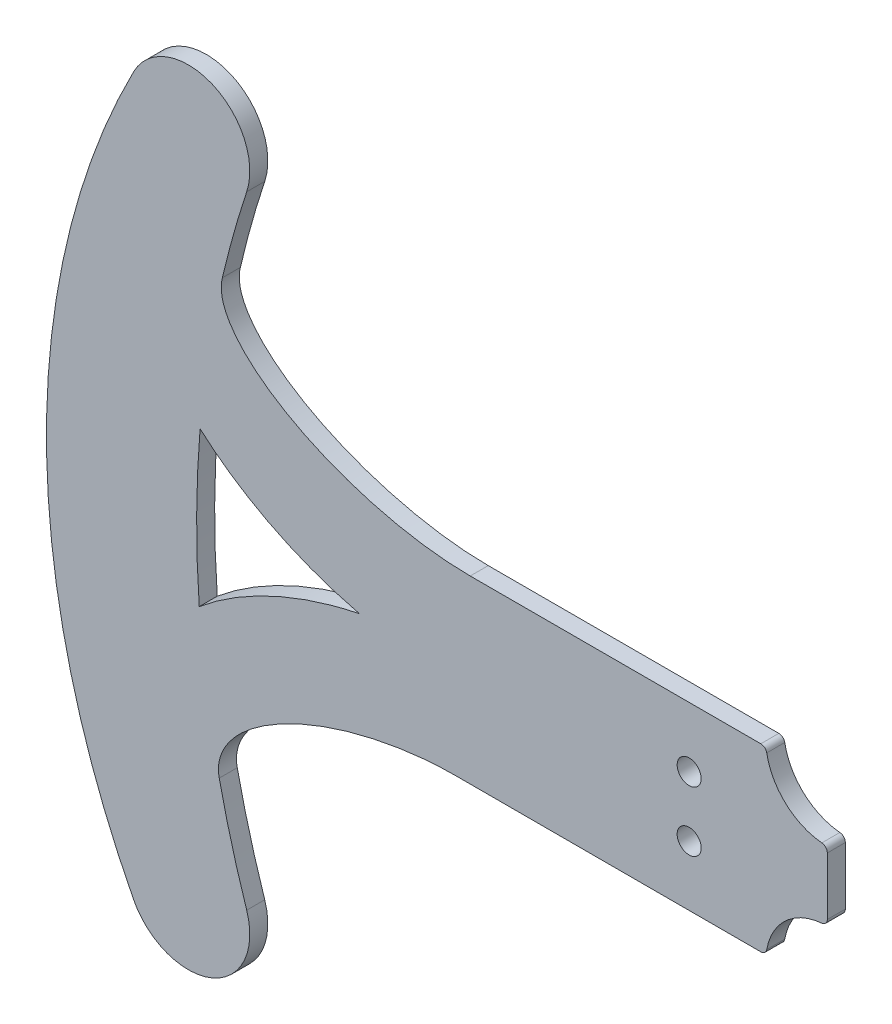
SolidWorks part; units mm, degrees
ref_plane "Face" through (0, 0, 0) normal (0, 0, 1) x (1, 0, 0)
ref_plane "Dessus" through (0, 0, 0) normal (0, 1, 0) x (1, 0, 0)
ref_plane "Droite" through (0, 0, 0) normal (1, 0, 0) x (0, 0, -1)
sketch "Esquisse2" plane through (0, 0, 0) normal (0, 0, 1) x (1, 0, 0)
  line L0 (-59.4512, 15) -> (-11.0708, 15)
  line L1 (0, 4.7945) -> (0, -4.7945)
  line L2 (-11.0708, -15) -> (-61.8043, -15)
  line L3 (-115.4583, 41.2625) -> (-27.9518, 18.1713) construction
  line L4 (-116.2088, -37.9474) -> (-27.4753, -20.1444) construction
  arc A0 (-115.48, 59.7023) -> (-115.48, -59.7023) centre (0, 0) ccw
  arc A1 (-96.6626, 51.7864) -> (-100.7121, 37.3713) centre (60, 0) ccw
  arc A2 (-96.6626, 51.7864) -> (-115.48, 59.7023) centre (-106.3844, 55) ccw
  arc A3 (-115.48, -59.7023) -> (-96.6626, -51.7864) centre (-106.3844, -55) ccw
  arc A4 (-10.0867, 14.1778) -> (-0.9111, 5.7906) centre (0, 16) ccw
  arc A5 (-0.9111, -5.7906) -> (-10.0867, -14.1778) centre (0, -16) ccw
  arc A6 (-101.2375, -35.0354) -> (-96.6626, -51.7864) centre (60, 0) ccw
  arc A7 (-10.0867, 14.1778) -> (-11.0708, 15) centre (-11.0708, 14) ccw
  arc A8 (0, 4.7945) -> (-0.9111, 5.7906) centre (-1, 4.7945) ccw
  arc A9 (-0.9111, -5.7906) -> (0, -4.7945) centre (-1, -4.7945) ccw
  arc A10 (-11.0708, -15) -> (-10.0867, -14.1778) centre (-11.0708, -14) ccw
  circle A11 centre (-23, 5) radius 2
  arc A12 (-104.4265, 13.7447) -> (-104.5653, -11.9687) centre (60, 0) ccw
  circle A13 centre (-23, -5) radius 2
  ellipse E0 centre (-71.705, 29.7169) end of major axis (-100.7121, 37.3713) minor radius 13 (-100.7121, 37.3713) -> (-59.4512, 15) ccw
  ellipse E1 centre (-71.842, -29.0459) end of major axis (-101.2559, -34.9473) minor radius 13 (-61.8043, -15) -> (-101.2375, -35.0354) ccw
  ellipse E2 centre (-71.705, 29.7169) end of major axis (-27.9518, 18.1713) minor radius 30 (-104.4265, 13.7447) -> (-77.8874, 0.3389) ccw
  ellipse E3 centre (-71.842, -29.0459) end of major axis (-27.4753, -20.1444) minor radius 30 (-77.8874, 0.3389) -> (-104.5653, -11.9687) ccw
  dimension "D2" = 130
  dimension "D5" = 10.2392
  dimension "D6" = 20.5
  dimension "D15" = 1
  dimension "D18" = 165
  dimension "D19" = 4
  dimension "D20" = 10
  dimension "D22" = 23
  dimension "D3" = 110
  dimension "D4" = 60
  dimension "D7" = 16
  dimension "D8" = 16
  dimension "D9" = 30
  dimension "D10" = 15
  dimension "D11" = 26
  dimension "D12" = 60
  dimension "D13" = 26
  dimension "D14" = 60
  dimension "D16" = 60
  dimension "D17" = 60
  dimension "D21" = 10
extrude "Extrusion2" add sketch "Esquisse2" along normal blind 3
